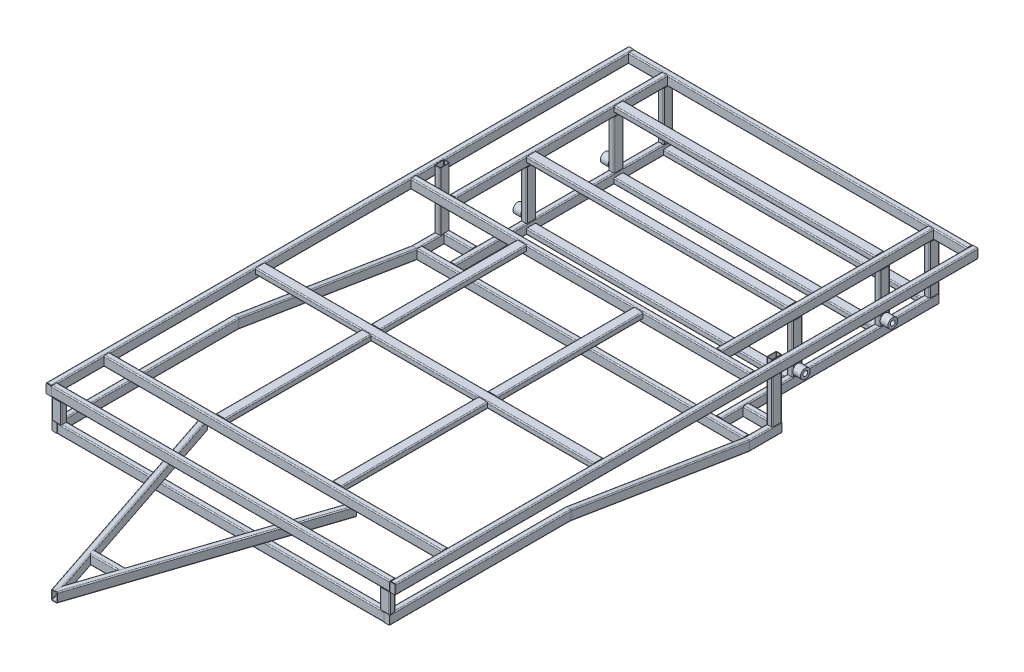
SolidWorks part; units mm, degrees
ref_plane "Front Plane" through (0, 0, 0) normal (0, 0, 1) x (1, 0, 0)
ref_plane "Top Plane" through (0, 0, 0) normal (0, 1, 0) x (1, 0, 0)
ref_plane "Right Plane" through (0, 0, 0) normal (1, 0, 0) x (0, 0, -1)
sketch "Para1" plane through (0, 0, 0) normal (0, 1, 0) x (1, 0, 0)
  line L0 (-900, 775) -> (900, 775)
  line L1 (900, -1075) -> (-900, -1075)
  line L2 (900, -1075) -> (900, 1925)
  line L3 (900, 1925) -> (-900, 1925)
  line L4 (-900, -1075) -> (-900, 1925)
  line L5 (900, -775) -> (-900, 775) construction
  line L6 (-900, -775) -> (900, 775) construction
  line L7 (-700, 775) -> (-700, 1925)
  line L8 (700, 775) -> (700, 1925)
  line L9 (700, 1195) -> (-700, 1195)
  line L10 (0, 775) -> (0, 1195) construction
  line L11 (-900, -775) -> (900, -775)
  point P0 (0, 0)
sketch "Para2" plane through (0, 0, 0) normal (0, 1, 0) x (1, 0, 0)
  line L0 (-900, 0) -> (900, 0)
  line L1 (-900, -1075) -> (-900, 1925) construction
  line L2 (900, -1075) -> (900, 1925) construction
  line L5 (300, 775) -> (300, 0)
  line L12 (-900, 775) -> (900, 775) construction
  dimension "横向间距" = 600
  dimension "纵向间距" = 775
sketch3d "3DSketch1"
  line L0 (700, -350, -1925) -> (700, -350, -775)
  line L1 (-700, -350, -1925) -> (-700, -350, -775)
  line L2 (700, -350, -1195) -> (-700, -350, -1195)
  line L3 (-870, -350, -775) -> (870, -350, -775)
  line L4 (700, 0, -1195) -> (700, -350, -1195)
  line L5 (700, 0, -1925) -> (700, -350, -1925)
  line L6 (-700, 0, -1925) -> (-700, -350, -1925)
  line L7 (-700, 0, -1195) -> (-700, -350, -1195)
  line L8 (870, 0, -945) -> (870, -350, -945)
  line L10 (-870, 0, -945) -> (-870, -350, -945)
  line L12 (870, -350, -945) -> (870, -350, -775)
  line L13 (-870, -350, -945) -> (-870, -350, -775)
  line L14 (870, -350, -945) -> (700, -350, -945)
  line L15 (-870, -350, -945) -> (-700, -350, -945)
  line L16 (0, 0, -775) -> (0, -350, -775) construction
  line L17 (700, -350, -1925) -> (-700, -350, -1925)
  line L18 (870, 0, 1075) -> (870, -200, 1075)
  line L19 (870, -200, 1075) -> (870, -200, 143.9189)
  line L20 (870, -200, 143.9189) -> (870, -350, -775)
  line L21 (-870, 0, 1075) -> (-870, -200, 1075)
  line L22 (-870, -200, 1075) -> (-870, -200, 143.9189)
  line L23 (-870, -200, 143.9189) -> (-870, -350, -775)
  line L24 (900, 0, 1075) -> (-900, 0, 1075) construction
  line L25 (870, -200, 1075) -> (-870, -200, 1075)
  line L26 (870, -200, 143.9189) -> (870, -200, -945) construction
  line L27 (-870, -200, 143.9189) -> (-870, -200, -945) construction
  line L29 (-900, 0, 1075) -> (-900, 0, -1925) construction
  dimension "D1" = 350
  dimension "D2" = 200
  dimension "D3" = 30
other "Structural Member1"
ref_plane "Plane1" through (900, 0, 1075) normal (0, 0, -1) x (-1, 0, 0)
sketch "Sketch12" plane through (885, -25, 1075) normal (0, 0, -1) x (-1, 0, 0)
  line L0 (-9.8, -22.4) -> (9.8, -22.4)
  line L1 (-12.4, -19.8) -> (-12.4, 19.8)
  line L2 (9.8, 22.4) -> (-9.8, 22.4)
  line L3 (12.4, 19.8) -> (12.4, -19.8)
  line L4 (-9.8, -25) -> (9.8, -25)
  line L5 (-15, -19.8) -> (-15, 19.8)
  line L6 (9.8, 25) -> (-9.8, 25)
  line L7 (15, 19.8) -> (15, -19.8)
  arc A0 (15, 19.8) -> (9.8, 25) centre (9.8, 19.8) ccw
  arc A1 (9.8, -25) -> (15, -19.8) centre (9.8, -19.8) ccw
  arc A2 (-15, -19.8) -> (-9.8, -25) centre (-9.8, -19.8) ccw
  arc A3 (-9.8, 25) -> (-15, 19.8) centre (-9.8, 19.8) ccw
  arc A4 (-9.8, 22.4) -> (-12.4, 19.8) centre (-9.8, 19.8) ccw
  arc A5 (12.4, 19.8) -> (9.8, 22.4) centre (9.8, 19.8) ccw
  arc A6 (9.8, -22.4) -> (12.4, -19.8) centre (9.8, -19.8) ccw
  arc A7 (-12.4, -19.8) -> (-9.8, -22.4) centre (-9.8, -19.8) ccw
  point P0 (0, 25)
  point P1 (15, 0)
  point P2 (0, -25)
  point P3 (-15, 0)
  point P4 (-15, 25)
  point P5 (15, 25)
  point P6 (15, -25)
  point P7 (-15, -25)
  point P8 (0, 0)
  point P33 (0, 0)
  dimension "D1" = 5.2
  dimension "Thickness" = 2.6
  dimension "V_leg" = 50
  dimension "H_leg" = 30
sketch3d "3DSketch2"
  line L0 (-400, -50, 775) -> (0, -50, 1975)
  line L1 (0, -50, 1975) -> (400, -50, 775)
  line L2 (0, -50, 1975) -> (0, -50, 775) construction
  line L3 (-400, -50, 775) -> (400, -50, 775) construction
  line L4 (0, -50, 775) -> (0, 0, 775) construction
  line L5 (-900, 0, 775) -> (900, 0, 775) construction
  line L6 (-100, -50, 1675) -> (100, -50, 1675)
  dimension "D1" = 50
  dimension "D2" = 1200
  dimension "D3" = 800
  dimension "D4" = 200
other "Structural Member5"
ref_plane "Plane12" through (-400, -50, 775) normal (0.3162, 0, 0.9487) x (0.9487, 0, -0.3162)
sketch "Sketch19" plane through (-385.7698, -75, 770.2566) normal (0.3162, 0, 0.9487) x (0.9487, 0, -0.3162)
  line L0 (-9.8, -22.4) -> (9.8, -22.4)
  line L1 (-12.4, -19.8) -> (-12.4, 19.8)
  line L2 (9.8, 22.4) -> (-9.8, 22.4)
  line L3 (12.4, 19.8) -> (12.4, -19.8)
  line L4 (-9.8, -25) -> (9.8, -25)
  line L5 (-15, -19.8) -> (-15, 19.8)
  line L6 (9.8, 25) -> (-9.8, 25)
  line L7 (15, 19.8) -> (15, -19.8)
  arc A0 (15, 19.8) -> (9.8, 25) centre (9.8, 19.8) ccw
  arc A1 (9.8, -25) -> (15, -19.8) centre (9.8, -19.8) ccw
  arc A2 (-15, -19.8) -> (-9.8, -25) centre (-9.8, -19.8) ccw
  arc A3 (-9.8, 25) -> (-15, 19.8) centre (-9.8, 19.8) ccw
  arc A4 (-9.8, 22.4) -> (-12.4, 19.8) centre (-9.8, 19.8) ccw
  arc A5 (12.4, 19.8) -> (9.8, 22.4) centre (9.8, 19.8) ccw
  arc A6 (9.8, -22.4) -> (12.4, -19.8) centre (9.8, -19.8) ccw
  arc A7 (-12.4, -19.8) -> (-9.8, -22.4) centre (-9.8, -19.8) ccw
  point P0 (0, 25)
  point P1 (15, 0)
  point P2 (0, -25)
  point P3 (-15, 0)
  point P4 (-15, 25)
  point P5 (15, 25)
  point P6 (15, -25)
  point P7 (-15, -25)
  point P8 (0, 0)
  point P33 (0, 0)
  dimension "D1" = 5.2
  dimension "Thickness" = 2.6
  dimension "V_leg" = 50
  dimension "H_leg" = 30
other "Trim/Extend9"
sketch "Sketch20" plane through (0, -50, 0) normal (0, 1, 0) x (1, 0, 0)
  line L0 (-400, -775) -> (0, -1975) construction
  line L1 (-15, -1930) -> (15, -1930)
  line L2 (-15, -1930) -> (-15, -1975)
  line L3 (-15, -1975) -> (15, -1975)
  line L4 (15, -1930) -> (15, -1975)
  line L5 (0, -1975) -> (400, -775) construction
  dimension "D1" = 30
extrude "Cut-Extrude1" cut sketch "Sketch20" against normal through all
sketch "Sketch21" plane through (700, 0, 0) normal (1, 0, 0) x (0, 0, -1)
  line L0 (1170, -275) -> (1220, -275) construction
  line L1 (1170, -300) -> (1170, -50) construction
  line L2 (1220, -300) -> (1220, -50) construction
  line L3 (805, -300) -> (1925, -300) construction
  circle A0 centre (1195, -275) radius 25
  circle A1 centre (1195, -275) radius 12.5
  dimension "D1" = 50
  dimension "D2" = 25
extrude "Extrude1" add sketch "Sketch21" along normal blind 40 separate body
mirror "Mirror1" about plane through (0, 0, 0) normal (1, 0, 0)
other "End cap1" parameters "D1"=3, "D2"=5, "D3"=3
other "Structural Member3"
ref_plane "Plane7" through (-900, 0, 0) normal (1, 0, 0) x (0, 1, 0)
sketch "Sketch17" plane through (-900, -15, 0) normal (1, 0, 0) x (0, 1, 0)
  line L0 (-9.8, -22.4) -> (9.8, -22.4)
  line L1 (-12.4, -19.8) -> (-12.4, 19.8)
  line L2 (9.8, 22.4) -> (-9.8, 22.4)
  line L3 (12.4, 19.8) -> (12.4, -19.8)
  line L4 (-9.8, -25) -> (9.8, -25)
  line L5 (-15, -19.8) -> (-15, 19.8)
  line L6 (9.8, 25) -> (-9.8, 25)
  line L7 (15, 19.8) -> (15, -19.8)
  arc A0 (15, 19.8) -> (9.8, 25) centre (9.8, 19.8) ccw
  arc A1 (9.8, -25) -> (15, -19.8) centre (9.8, -19.8) ccw
  arc A2 (-15, -19.8) -> (-9.8, -25) centre (-9.8, -19.8) ccw
  arc A3 (-9.8, 25) -> (-15, 19.8) centre (-9.8, 19.8) ccw
  arc A4 (-9.8, 22.4) -> (-12.4, 19.8) centre (-9.8, 19.8) ccw
  arc A5 (12.4, 19.8) -> (9.8, 22.4) centre (9.8, 19.8) ccw
  arc A6 (9.8, -22.4) -> (12.4, -19.8) centre (9.8, -19.8) ccw
  arc A7 (-12.4, -19.8) -> (-9.8, -22.4) centre (-9.8, -19.8) ccw
  point P0 (0, 25)
  point P1 (15, 0)
  point P2 (0, -25)
  point P3 (-15, 0)
  point P4 (-15, 25)
  point P5 (15, 25)
  point P6 (15, -25)
  point P7 (-15, -25)
  point P8 (0, 0)
  point P33 (0, 0)
  dimension "D1" = 5.2
  dimension "Thickness" = 2.6
  dimension "V_leg" = 50
  dimension "H_leg" = 30
other "Structural Member4"
ref_plane "Plane8" through (300, 0, -775) normal (0, 0, 1) x (0, 1, 0)
sketch "Sketch18" plane through (300, -15, -775) normal (0, 0, 1) x (0, 1, 0)
  line L0 (-9.8, -22.4) -> (9.8, -22.4)
  line L1 (-12.4, -19.8) -> (-12.4, 19.8)
  line L2 (9.8, 22.4) -> (-9.8, 22.4)
  line L3 (12.4, 19.8) -> (12.4, -19.8)
  line L4 (-9.8, -25) -> (9.8, -25)
  line L5 (-15, -19.8) -> (-15, 19.8)
  line L6 (9.8, 25) -> (-9.8, 25)
  line L7 (15, 19.8) -> (15, -19.8)
  arc A0 (15, 19.8) -> (9.8, 25) centre (9.8, 19.8) ccw
  arc A1 (9.8, -25) -> (15, -19.8) centre (9.8, -19.8) ccw
  arc A2 (-15, -19.8) -> (-9.8, -25) centre (-9.8, -19.8) ccw
  arc A3 (-9.8, 25) -> (-15, 19.8) centre (-9.8, 19.8) ccw
  arc A4 (-9.8, 22.4) -> (-12.4, 19.8) centre (-9.8, 19.8) ccw
  arc A5 (12.4, 19.8) -> (9.8, 22.4) centre (9.8, 19.8) ccw
  arc A6 (9.8, -22.4) -> (12.4, -19.8) centre (9.8, -19.8) ccw
  arc A7 (-12.4, -19.8) -> (-9.8, -22.4) centre (-9.8, -19.8) ccw
  point P0 (0, 25)
  point P1 (15, 0)
  point P2 (0, -25)
  point P3 (-15, 0)
  point P4 (-15, 25)
  point P5 (15, 25)
  point P6 (15, -25)
  point P7 (-15, -25)
  point P8 (0, 0)
  point P33 (0, 0)
  dimension "D1" = 5.2
  dimension "Thickness" = 2.6
  dimension "V_leg" = 50
  dimension "H_leg" = 30
other "Trim/Extend7"
other "Trim/Extend8"
pattern_linear "LPattern3" count 2 spacing 450 along (0, 0, -1)
mirror "Mirror6" about plane through (0, 0, 0) normal (0, 0, 1)
mirror "Mirror8" about plane through (0, 0, 0) normal (1, 0, 0)
equation "\"Jockey Wheel\"=1"
equation "\"Length\"=3000"
equation "\"Width\"=1800"
equation "\"Width@Para1\" = \"Width\""
equation "\"Length@Para1\" = \"Length\""
equation "\"LPattern4\"= iif ( \"Width@Para1\" > 1500 ,  unsuppressed  ,  suppressed  ) "
equation "\"Mirror7\"= iif ( \"车身@Para1\" > 1650 ,  unsuppressed  ,  suppressed  ) "
